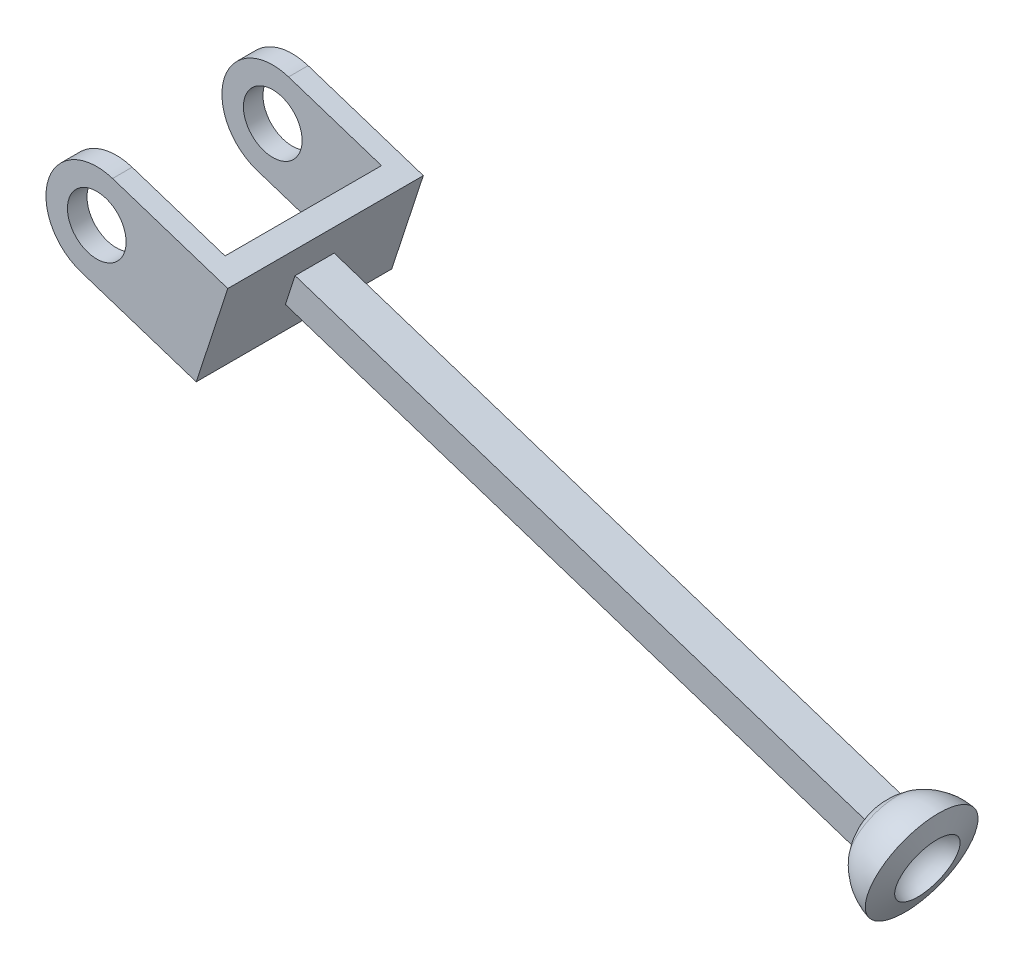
SolidWorks part; units mm, degrees
ref_plane "Plane1" through (0, 0, 0) normal (0, 0, 1) x (1, 0, 0)
ref_plane "Plane2" through (0, 0, 0) normal (0, 1, 0) x (1, 0, 0)
ref_plane "Plane3" through (0, 0, 0) normal (1, 0, 0) x (0, 0, -1)
imported_body "Imported1"
ref_plane "Plane4" through (0, -0.0002, -22.8247) normal (0, 0, 1) x (1, 0, 0)
sketch "Sketch2" plane through (0, -0.0001, -22.8247) normal (0, 0, 1) x (1, 0, 0)
  line L1 (13186.688, 5762.4074) -> (13190.5511, 5761.1455)
  line L2 (13197.1805, 5768.5332) -> (13196.9573, 5764.3971)
  line L3 (13093.4608, 5795.531) -> (13189.8639, 5764.0421) construction
  line L4 (13202.989, 5757.0829) -> (13180.1514, 5764.5425) construction
  line L5 (13191.9234, 5760.6973) -> (13193.0667, 5760.3238) construction
  arc A0 (13196.9573, 5764.3971) -> (13190.5511, 5761.1455) centre (13195.38, 5759.5682) ccw
  arc A1 (13197.1805, 5768.5332) -> (13186.688, 5762.4074) centre (13195.38, 5759.5682) ccw
  dimension "D2" = 9.144
  dimension "D3" = 75
  dimension "D1" = 5.08
revolve "Boss-Revolve1" add sketch "Sketch2" angle 360 about L4
sketch "Sketch3" plane through (0, 0, -22.8247) normal (0, 0, 1) x (1, 0, 0)
  line L1 (13202.0876, 5757.3772) -> (13180.1514, 5764.5424) construction
  line L2 (13189.6374, 5766.7369) -> (13186.9622, 5770.2984)
  line L3 (13202.989, 5757.0828) -> (13180.1514, 5764.5424) construction
  line L5 (13202.0876, 5757.3772) -> (13206.1909, 5769.9394)
  line L6 (13199.0597, 5772.2687) -> (13206.1909, 5769.9394)
  line L7 (13196.9573, 5764.3971) -> (13198.0968, 5767.8856)
  line L8 (13202.0876, 5757.3772) -> (13190.5511, 5761.1454)
  arc A0 (13196.9573, 5764.3971) -> (13190.5511, 5761.1454) centre (13195.38, 5759.5681) ccw construction
  arc A1 (13198.0968, 5767.8856) -> (13189.6374, 5766.7369) centre (13194.9164, 5759.584) ccw
  arc A2 (13199.0597, 5772.2687) -> (13186.9622, 5770.2984) centre (13194.9164, 5759.584) ccw
  arc A3 (13196.9573, 5764.3971) -> (13190.5511, 5761.1454) centre (13195.38, 5759.5681) ccw
  dimension "D2" = 90
  dimension "D3" = 7.5019
  dimension "D4" = 8.89
  dimension "D5" = 13.3442
  dimension "D1" = 55
  dimension "D6" = 12.1363
revolve "Cut-Revolve1" cut sketch "Sketch3" angle 360 about L1
sketch "Sketch5" plane through (10120.6297, -3305.7792, 0.0171) normal (0.9506, -0.3105, 0) x (0, 0, -1)
  line L4 (38.7651, 9580.242) -> (7.0151, 9580.2422)
  line L5 (7.0151, 9580.2422) -> (7.015, 9563.7322)
  line L6 (7.015, 9563.7322) -> (38.765, 9563.732)
  line L7 (38.765, 9563.732) -> (38.7651, 9580.242)
  line L8 (38.7651, 9580.242) -> (7.0151, 9580.2422)
  line L9 (7.0151, 9580.2422) -> (7.015, 9563.7322)
  line L10 (7.015, 9563.7322) -> (38.765, 9563.732)
  line L11 (38.765, 9563.732) -> (38.7651, 9580.242)
  dimension "D1" = 0
extrude "Boss-Extrude1" add sketch "Sketch5" along normal blind 2.54
sketch "Sketch4" plane through (10114.5936, -3303.8076, 0.0171) normal (-0.9506, 0.3105, 0) x (0, 0, 1)
  line L4 (-10.1901, 9580.2422) -> (-35.5901, 9580.242)
  line L5 (-35.5901, 9580.242) -> (-35.59, 9563.732)
  line L6 (-35.59, 9563.732) -> (-10.19, 9563.7322)
  line L7 (-10.19, 9563.7322) -> (-10.1901, 9580.2422)
  line L8 (-10.1901, 9580.2422) -> (-35.5901, 9580.242)
  line L9 (-35.5901, 9580.242) -> (-35.59, 9563.732)
  line L10 (-35.59, 9563.732) -> (-10.19, 9563.7322)
  line L11 (-10.19, 9563.7322) -> (-10.1901, 9580.2422)
  dimension "D1" = 0
extrude "Cut-Extrude1" cut sketch "Sketch4" against normal blind 5.08
